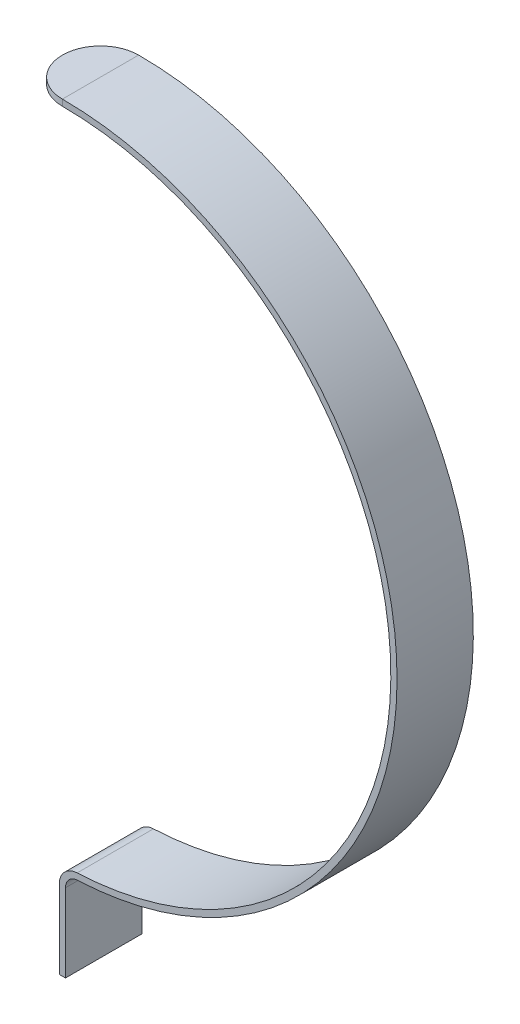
SolidWorks part; units mm, degrees
ref_plane "Plane1" through (0, 0, 0) normal (0, 0, 1) x (1, 0, 0)
ref_plane "Plane2" through (0, 0, 0) normal (0, 1, 0) x (1, 0, 0)
ref_plane "Plane3" through (0, 0, 0) normal (1, 0, 0) x (0, 0, -1)
sketch "Sketch1" plane through (0, 0, 0) normal (0, 0, 1) x (1, 0, 0)
  line L0 (0, -7.62) -> (0, -1.2415)
  arc A0 (1.213, 0.0272) -> (0, 54.102) centre (0, 27.051) ccw
  arc A1 (1.213, 0.0272) -> (0, -1.2415) centre (1.27, -1.2415) ccw
  point P8 (0, 0)
  dimension "D1" = 27.051
  dimension "D3" = 1.27
  dimension "D2" = 7.62
ref_plane "Plane4" through (0, -7.62, 0) normal (0, 1, 0) x (-1, 0, 0)
sketch "Sketch2" plane through (0, -7.62, 0) normal (0, 1, 0) x (-1, 0, 0)
  line L0 (0.254, 3.1115) -> (-0.254, 3.1115)
  line L1 (0.254, 3.1115) -> (0.254, -3.1115)
  line L2 (-0.254, -3.1115) -> (0.254, -3.1115)
  line L3 (-0.254, -3.1115) -> (-0.254, 3.1115)
  point P4 (0, 3.1115)
  point P5 (-0.254, 0)
  dimension "D1" = 0.508
  dimension "D2" = 6.223
sweep "Base-Sweep" add profiles "Sketch2" path "Sketch1"
sketch "Sketch3" plane through (0, 0, 0) normal (-1, 0, 0) x (0, 0, 1)
  line L0 (0, 54.9199) -> (0, 52.8884) construction
  line L1 (0, 54.356) -> (0, 53.848)
  line L4 (-3.1115, 53.848) -> (3.1115, 53.848)
  line L5 (3.1115, 53.848) -> (3.1115, 54.356)
  line L6 (3.1115, 54.356) -> (-3.1115, 54.356)
  line L7 (-3.1115, 54.356) -> (-3.1115, 53.848)
  line L8 (0, 53.848) -> (3.1115, 53.848)
  line L9 (3.1115, 53.848) -> (3.1115, 54.356)
  line L10 (3.1115, 54.356) -> (0, 54.356)
  dimension "D1" = 0
revolve "Boss-Revolve1" add sketch "Sketch3" angle 180 about L0
